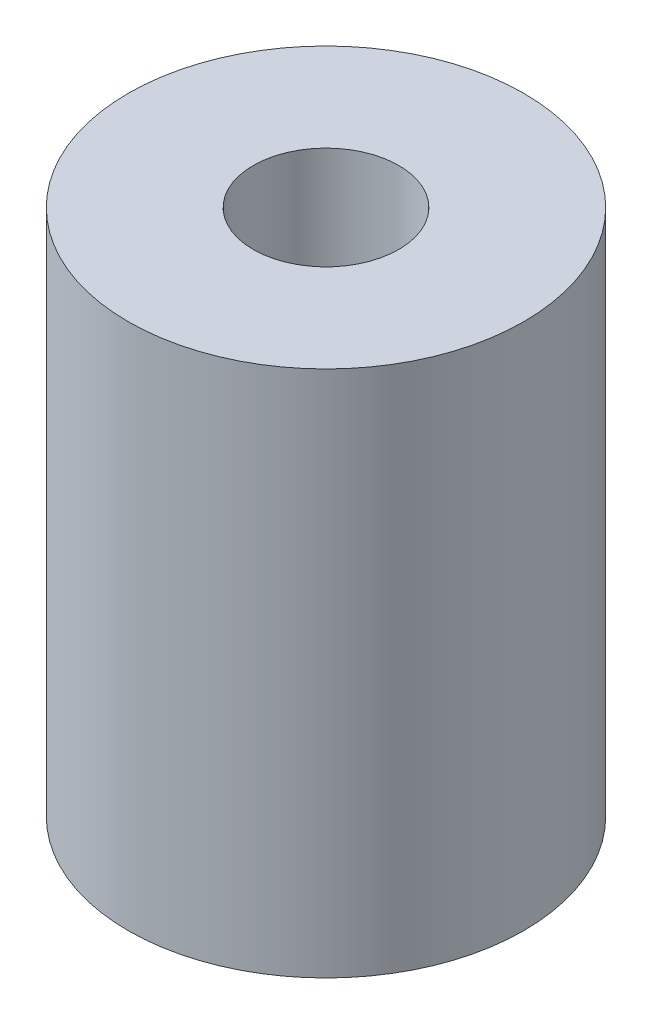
SolidWorks part; units mm, degrees
ref_plane "Front Plane" through (0, 0, 0) normal (0, 0, 1) x (1, 0, 0)
ref_plane "Top Plane" through (0, 0, 0) normal (0, 1, 0) x (1, 0, 0)
ref_plane "Right Plane" through (0, 0, 0) normal (1, 0, 0) x (0, 0, -1)
sketch "Sketch1" plane through (0, 0, 0) normal (0, 1, 0) x (1, 0, 0)
  circle A0 centre (0, 0) radius 4.7625
  dimension "D1" = 9.525
extrude "Extrude1" add sketch "Sketch1" along normal blind 12.7
sketch "Sketch2" plane through (0, 12.7, 0) normal (0, 1, 0) x (-1, 0, 0)
  point P0 (0, 0)
hole_wizard "#6-32 Tapped Hole1" positions "3DSketch1" profile "Sketch3" tap size "#6-32" standard "Ansi Inch"
sketch3d "3DSketch1"
  point P0 (0, 12.7, 0)
sketch "Sketch3" plane through (0, 12.7, 0) normal (1, 0, 0) x (0, 0, 1)
  line L0 (0, 0) -> (0, 12.7)
  line L1 (0, 12.7) -> (1.7526, 12.7)
  line L2 (1.7526, 12.7) -> (1.7526, 0)
  line L5 (1.7526, 0) -> (0, 0)
  line L11 (0, -6.35) -> (0, 107.95) construction
  dimension "Thread Major Dia." = 3.5052
  dimension "Thru Tap Drill Depth" = 12.7
sketch "Sketch4" plane through (0, 0, 0) normal (0, -1, 0) x (1, 0, 0)
  circle A0 centre (0, 0) radius 1.7526
